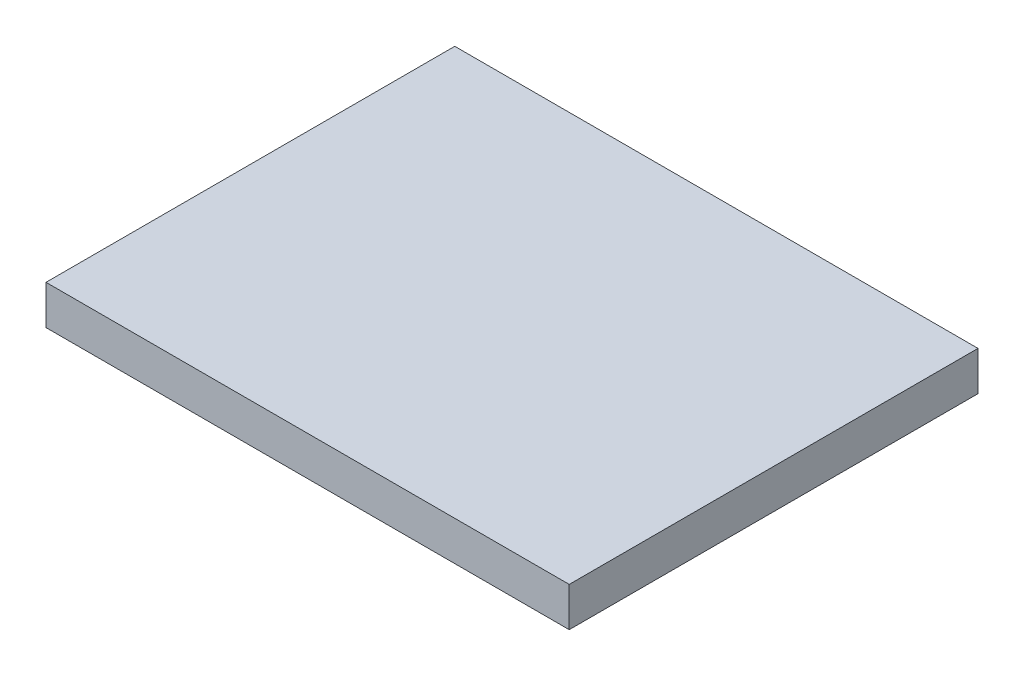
SolidWorks part; units mm, degrees
ref_plane "Front Plane" through (0, 0, 0) normal (0, 0, 1) x (1, 0, 0)
ref_plane "Top Plane" through (0, 0, 0) normal (0, 1, 0) x (1, 0, 0)
ref_plane "Right Plane" through (0, 0, 0) normal (1, 0, 0) x (0, 0, -1)
sketch "Sketch1" plane through (0, 0, 0) normal (0, 1, 0) x (1, 0, 0)
  line L1 (40, -31.25) -> (-40, -31.25)
  line L2 (40, -31.25) -> (40, 31.25)
  line L3 (40, 31.25) -> (-40, 31.25)
  line L4 (-40, -31.25) -> (-40, 31.25)
  line L5 (40, -31.25) -> (-40, 31.25) construction
  line L6 (40, 31.25) -> (-40, -31.25) construction
  point P0 (0, 0)
  dimension "D1" = 80
  dimension "D2" = 62.5
extrude "Boss-Extrude1" add sketch "Sketch1" along normal blind 6
